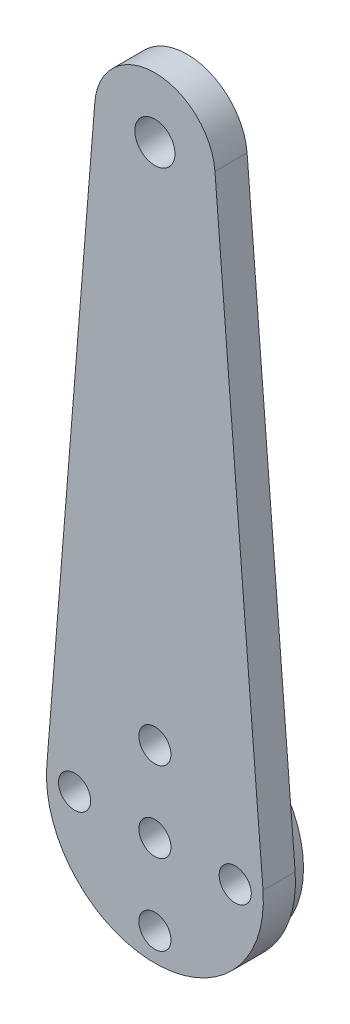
SolidWorks part; units mm, degrees
ref_plane "Front Plane" through (0, 0, 0) normal (0, 0, 1) x (1, 0, 0)
ref_plane "Top Plane" through (0, 0, 0) normal (0, 1, 0) x (1, 0, 0)
ref_plane "Right Plane" through (0, 0, 0) normal (1, 0, 0) x (0, 0, -1)
sketch "Sketch2" plane through (0, 0, 0) normal (0, 0, 1) x (1, 0, 0)
  line L1 (10, 0) -> (0, 10) construction
  line L2 (0, 10) -> (-10, 0) construction
  line L3 (-10, 0) -> (0, -10) construction
  line L4 (0, -10) -> (10, 0) construction
  circle A0 centre (0, 0) radius 12.5
  circle A1 centre (0, 0) radius 10 construction
  circle A2 centre (0, 0) radius 2
  circle A3 centre (0, 10) radius 2
  circle A4 centre (10, 0) radius 2
  circle A5 centre (0, -10) radius 2
  circle A6 centre (-10, 0) radius 2
  point P9 (10, 0)
  point P11 (0, -10)
  point P14 (-0.4232, 9.5646)
  point P16 (-9.6085, 0)
  point P17 (0.6673, 9.9926)
  dimension "D1" = 25
  dimension "D2" = 20
  dimension "D3" = 4
extrude "Boss-Extrude1" add sketch "Sketch2" along normal blind 2 contours A0 A6 A5 A4 A3 A2
sketch "Sketch3" plane through (0, 0, 0) normal (0, 0, -1) x (-1, 0, 0)
  circle A0 centre (0, 0) radius 4.5
  circle A1 centre (0, 0) radius 3.5
  dimension "D1" = 7
  dimension "D2" = 9
extrude "Boss-Extrude2" add sketch "Sketch3" along normal blind 3
sketch "Sketch4" plane through (0, 0, 2) normal (0, 0, 1) x (1, 0, 0)
  line L0 (0, 0) -> (0, 75) construction
  line L1 (-7.476, 75.6) -> (-13.4567, 1.08)
  line L2 (7.476, 75.6) -> (13.4567, 1.08)
  circle A0 centre (10, 0) radius 2 construction
  circle A3 centre (0, -10) radius 2 construction
  circle A4 centre (-10, 0) radius 2 construction
  circle A5 centre (0, 10) radius 2 construction
  circle A6 centre (10, 0) radius 2
  circle A7 centre (0, -10) radius 2
  circle A8 centre (-10, 0) radius 2
  circle A9 centre (0, 10) radius 2
  circle A10 centre (0, 75) radius 2.5
  arc A11 (7.476, 75.6) -> (-7.476, 75.6) centre (0, 75) ccw
  arc A12 (-7.476, 75.6) -> (0, 67.5) centre (0, 75) ccw construction
  arc A13 (0, 67.5) -> (7.476, 75.6) centre (0, 75) ccw construction
  arc A14 (0, 13.5) -> (-13.4567, 1.08) centre (0, 0) ccw construction
  circle A15 centre (0, 0) radius 13.5
  arc A16 (-13.4567, 1.08) -> (13.4567, 1.08) centre (0, 0) ccw
  arc A17 (13.4567, 1.08) -> (0, 13.5) centre (0, 0) ccw construction
  circle A18 centre (0, 0) radius 2 construction
  circle A19 centre (0, 0) radius 2
  point P5 (-13.4155, 1.5077)
  point P22 (-7.5, 75)
  dimension "D3" = 5
  dimension "D4" = 15
  dimension "D1" = 75
  dimension "D2" = 1
extrude "Boss-Extrude3" add sketch "Sketch4" along normal blind 4 separate body
